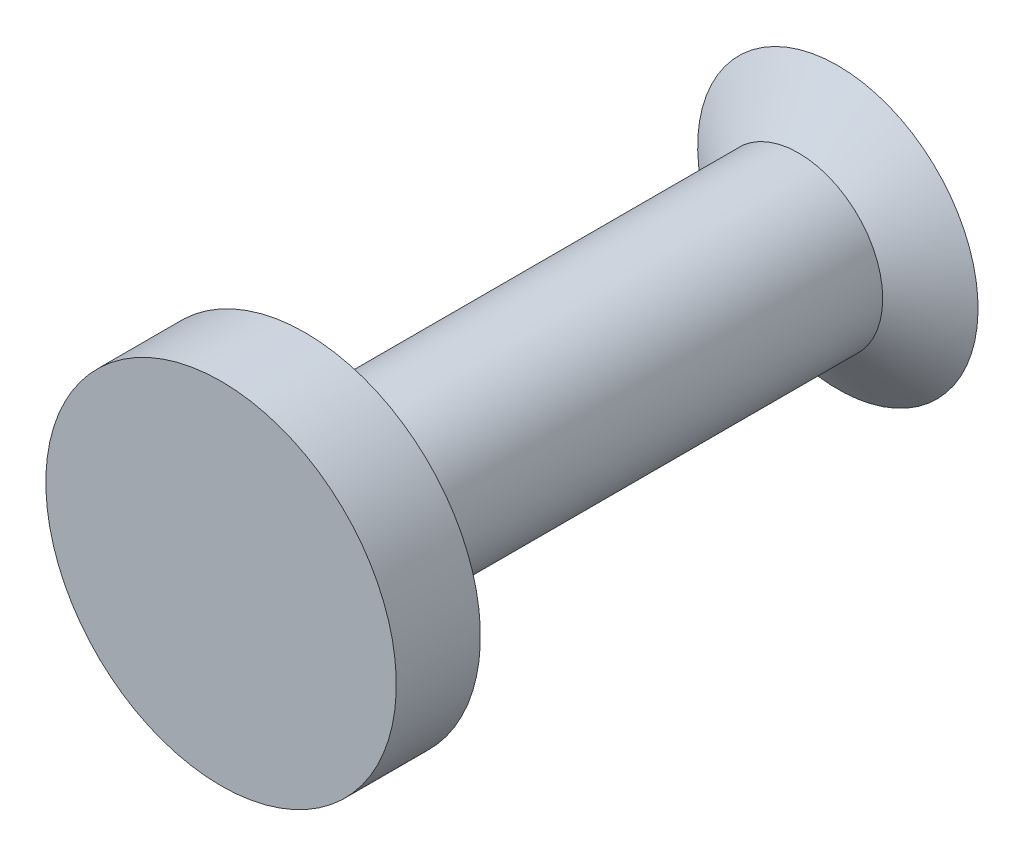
SolidWorks part; units mm, degrees
ref_plane "Front Plane" through (0, 0, 0) normal (0, 0, 1) x (1, 0, 0)
ref_plane "Top Plane" through (0, 0, 0) normal (0, 1, 0) x (1, 0, 0)
ref_plane "Right Plane" through (0, 0, 0) normal (1, 0, 0) x (0, 0, -1)
sketch "Sketch1" plane through (0, 0, 0) normal (1, 0, 0) x (0, 0, -1)
  line L0 (0, 0) -> (-5.588, 0)
  line L1 (0, 0) -> (0, 1.27)
  line L2 (0, 1.27) -> (-0.3557, 0.762)
  line L3 (-0.3557, 0.762) -> (-4.826, 0.762)
  line L4 (-4.826, 0.762) -> (-4.826, 1.5875)
  line L5 (-4.826, 1.5875) -> (-5.588, 1.5875)
  line L6 (-5.588, 1.5875) -> (-5.588, 0)
  line L7 (0, 0) -> (-8.7645, 0) construction
  point P1 (-4.826, 1.1747)
  dimension "D1" = 1.524
  dimension "D2" = 3.175
  dimension "D3" = 2.54
  dimension "D4" = 55
  dimension "D5" = 4.826
  dimension "D6" = 0.762
revolve "Revolve1" add sketch "Sketch1" angle 360 about L7
